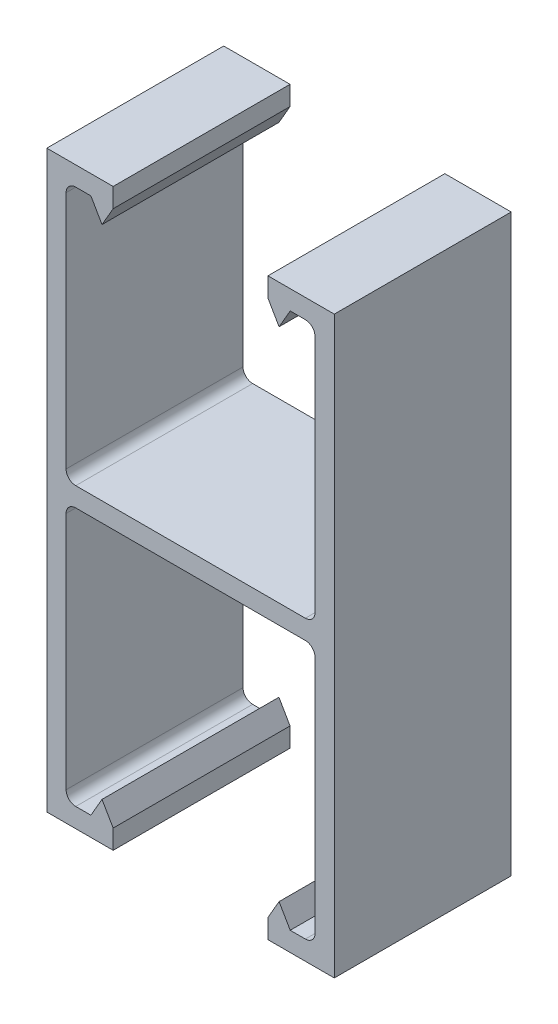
SolidWorks part; units mm, degrees
ref_plane "Plane1" through (0, 0, 0) normal (0, 0, 1) x (1, 0, 0)
ref_plane "Plane2" through (0, 0, 0) normal (0, 1, 0) x (1, 0, 0)
ref_plane "Plane3" through (0, 0, 0) normal (1, 0, 0) x (0, 0, -1)
sketch "Sketch1" plane through (0, 0, 0) normal (0, 0, 1) x (1, 0, 0)
  line L0 (-11.1125, 41.275) -> (-20.6375, 41.275)
  line L1 (-20.6375, 41.275) -> (-20.6375, -41.275)
  line L2 (-14.3094, -38.5064) -> (-16.4846, -38.5064)
  line L3 (20.6375, -41.275) -> (20.6375, 41.275)
  line L4 (20.6375, 41.275) -> (11.1125, 41.275)
  line L5 (16.4846, 38.5064) -> (14.3094, 38.5064)
  line L6 (17.8689, 2.7686) -> (17.8689, 37.1221)
  line L7 (-16.4846, 1.3843) -> (16.4846, 1.3843)
  line L8 (-17.8689, 37.1221) -> (-17.8689, 2.7686)
  line L9 (-14.3094, 38.5064) -> (-16.4846, 38.5064)
  line L10 (14.3094, 38.5064) -> (12.711, 35.7378)
  line L11 (12.711, 35.7378) -> (11.1125, 38.5064)
  line L12 (11.1125, 38.5064) -> (11.1125, 41.275)
  line L13 (-14.3094, 38.5064) -> (-12.711, 35.7378)
  line L14 (-12.711, 35.7378) -> (-11.1125, 38.5064)
  line L15 (-11.1125, 38.5064) -> (-11.1125, 41.275)
  line L16 (22.86, 0) -> (-25.4, 0) construction
  line L17 (12.711, -35.7378) -> (11.1125, -38.5064)
  line L18 (14.3094, -38.5064) -> (12.711, -35.7378)
  line L19 (16.4846, -38.5064) -> (14.3094, -38.5064)
  line L20 (20.6375, -41.275) -> (11.1125, -41.275)
  line L21 (11.1125, -38.5064) -> (11.1125, -41.275)
  line L22 (-11.1125, -41.275) -> (-20.6375, -41.275)
  line L23 (-11.1125, -38.5064) -> (-11.1125, -41.275)
  line L24 (-12.711, -35.7378) -> (-11.1125, -38.5064)
  line L25 (-14.3094, -38.5064) -> (-12.711, -35.7378)
  line L26 (-17.8689, -37.1221) -> (-17.8689, -2.7686)
  line L27 (17.8689, -2.7686) -> (17.8689, -37.1221)
  line L28 (-16.4846, -1.3843) -> (16.4846, -1.3843)
  arc A0 (-17.8689, 2.7686) -> (-16.4846, 1.3843) centre (-16.4846, 2.7686) ccw
  arc A1 (-16.4846, 38.5064) -> (-17.8689, 37.1221) centre (-16.4846, 37.1221) ccw
  arc A2 (17.8689, 37.1221) -> (16.4846, 38.5064) centre (16.4846, 37.1221) ccw
  arc A3 (16.4846, 1.3843) -> (17.8689, 2.7686) centre (16.4846, 2.7686) ccw
  arc A4 (17.8689, -37.1221) -> (16.4846, -38.5064) centre (16.4846, -37.1221) cw
  arc A5 (-16.4846, -38.5064) -> (-17.8689, -37.1221) centre (-16.4846, -37.1221) cw
  arc A6 (16.4846, -1.3843) -> (17.8689, -2.7686) centre (16.4846, -2.7686) cw
  arc A7 (-17.8689, -2.7686) -> (-16.4846, -1.3843) centre (-16.4846, -2.7686) cw
  dimension "D5" = 1.3843
  dimension "D3" = 41.275
  dimension "D4" = 60
  dimension "Width" = 41.275
  dimension "Height" = 82.55
  dimension "D8" = 20.6375
  dimension "D10" = 22.225
  dimension "edge" = 9.525
  dimension "D13" = 1.5985
extrude "Base-Extrude" add sketch "Sketch1" along normal mid plane 25.4
equation "\"D8@Sketch1\" = \"Width@Sketch1\" / 2"
equation "\"D10@Sketch1\" = \"Width@Sketch1\" - 2 * \"edge@Sketch1\""
equation "\"D5@Sketch1\" = \"gauge@Sketch1\" / 2"
equation "\"D3@Sketch1\" = \"Height@Sketch1\" / 2"
equation "\"D13@Sketch1\" = \"gauge@Sketch1\" * .577350269"
